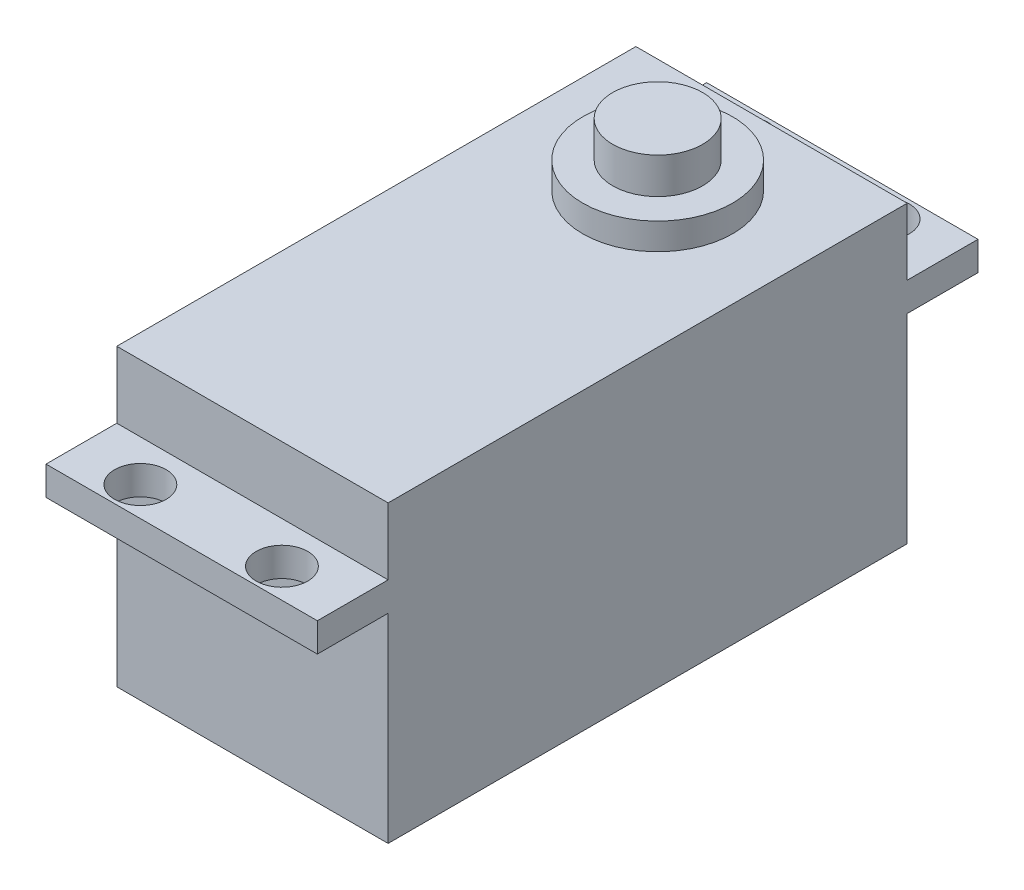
SolidWorks part; units mm, degrees
ref_plane "Front Plane" through (0, 0, 0) normal (0, 0, 1) x (1, 0, 0)
ref_plane "Top Plane" through (0, 0, 0) normal (0, 1, 0) x (1, 0, 0)
ref_plane "Right Plane" through (0, 0, 0) normal (1, 0, 0) x (0, 0, -1)
sketch "Sketch1" plane through (0, 0, 0) normal (0, 1, 0) x (1, 0, 0)
  line L0 (-11.5, 0) -> (11.5, 0) construction
  line L1 (-11.5, 22) -> (11.5, 22)
  line L2 (-11.5, 22) -> (-11.5, -22)
  line L3 (-11.5, -22) -> (11.5, -22)
  line L4 (11.5, 22) -> (11.5, -22)
  point P4 (-11.5, 0)
  point P5 (11.5, 0)
  dimension "D1" = 23
  dimension "D2" = 44
extrude "Extrude1" add sketch "Sketch1" along normal blind 25
sketch "Sketch3" plane through (0, 0, 22) normal (0, 0, 1) x (1, 0, 0)
  line L1 (-11.5, 19.35) -> (11.5, 19.35)
  line L2 (-11.5, 19.35) -> (-11.5, 16.9)
  line L3 (-11.5, 16.9) -> (11.5, 16.9)
  line L4 (11.5, 19.35) -> (11.5, 16.9)
  line L5 (11.5, 25) -> (11.5, 0) construction
  line L6 (-11.5, 25) -> (-11.5, 0) construction
  line L7 (-11.5, 0) -> (11.5, 0) construction
  dimension "D1" = 2.45
  dimension "D2" = 16.9
extrude "Extrude3" add sketch "Sketch3" along normal blind 6
mirror "Mirror1" about plane through (0, 0, 0) normal (0, 0, 1) of "Extrude3"
sketch "Sketch4" plane through (0, 25, 0) normal (0, 1, 0) x (1, 0, 0)
  line L0 (11.5, 22) -> (-11.5, 22) construction
  circle A0 centre (0, 12.348) radius 6.35
  dimension "D1" = 12.7
  dimension "D2" = 9.652
sketch "Sketch5" plane through (0, 19.35, 0) normal (0, 1, 0) x (1, 0, 0)
  line L0 (0, -22) -> (0, -28) construction
  line L1 (11.5, -22) -> (-11.5, -22) construction
  line L2 (11.5, -28) -> (-11.5, -28) construction
  circle A0 centre (6, -25.5) radius 2.1844
  point P6 (6, -25.5)
  dimension "D3" = 4.3688
  dimension "D1" = 3.5
  dimension "D2" = 6
extrude "Cut-Extrude1" cut sketch "Sketch5" against normal through all
mirror "Mirror2" about plane through (0, 0, 0) normal (0, 0, 1) of "Cut-Extrude1"
mirror "Mirror3" about plane through (0, 0, 0) normal (1, 0, 0) of "Mirror2", "Cut-Extrude1"
extrude "Extrude4" add sketch "Sketch4" along normal blind 2.252
sketch "Sketch6" plane through (0, 27.252, 0) normal (0, 1, 0) x (1, 0, 0)
  circle A0 centre (0, 12.348) radius 3.81
  point P0 (0, 12.348)
  dimension "D1" = 7.62
extrude "Extrude5" add sketch "Sketch6" along normal blind 3.048
